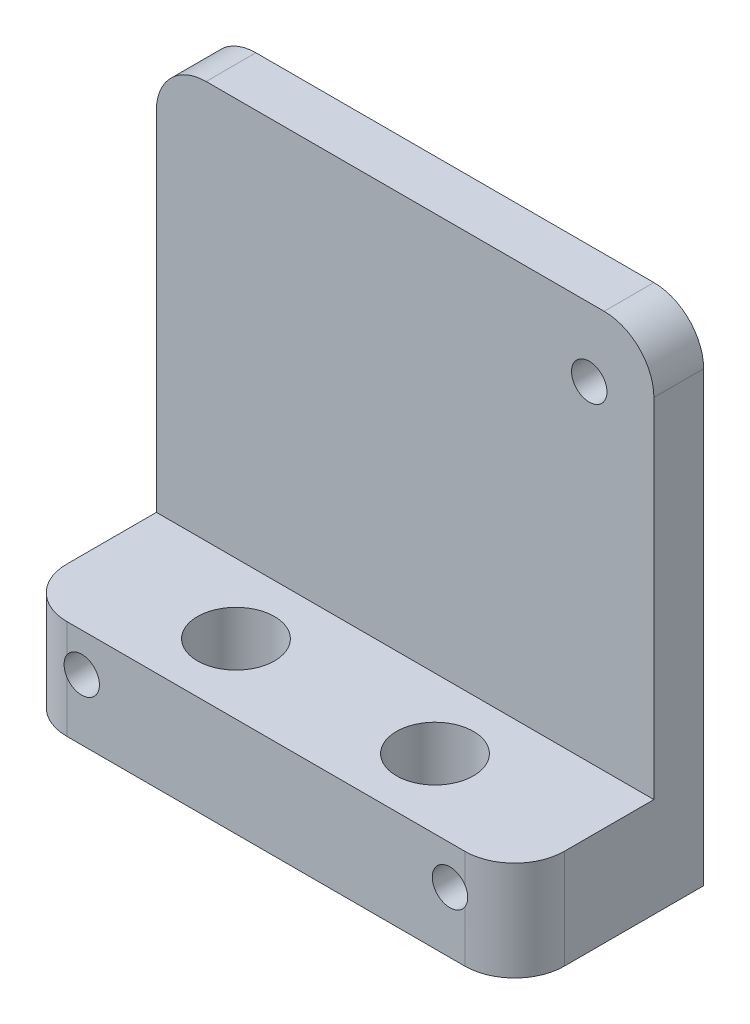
SolidWorks part; units mm, degrees
ref_plane "Front Plane" through (0, 0, 0) normal (0, 0, 1) x (1, 0, 0)
ref_plane "Top Plane" through (0, 0, 0) normal (0, 1, 0) x (1, 0, 0)
ref_plane "Right Plane" through (0, 0, 0) normal (1, 0, 0) x (0, 0, -1)
sketch "Sketch1" plane through (0, 0, 0) normal (1, 0, 0) x (0, 0, -1)
  line L0 (-12.065, 0) -> (0, 0)
  line L1 (0, 0) -> (0, 31.75)
  line L2 (0, 31.75) -> (-3.175, 31.75)
  line L3 (-3.175, 31.75) -> (-3.175, 6.35)
  line L4 (-3.175, 6.35) -> (-12.065, 6.35)
  line L5 (-12.065, 6.35) -> (-12.065, 0)
  dimension "D1" = 3.175
  dimension "D2" = 6.35
  dimension "D3" = 31.75
  dimension "D4" = 8.89
extrude "Boss-Extrude1" add sketch "Sketch1" along normal mid plane 31.75
hole_wizard "#4-40 Tapped Hole1" positions "Sketch3" profile "Sketch4" tap size "#4-40" standard "ANSI Inch"
sketch "Sketch3" plane through (0, 0, 0) normal (0, 0, -1) x (-1, 0, 0)
  circle A0 centre (-11.75, 27.385) radius 2.7 construction
  circle A1 centre (-11.75, 3.885) radius 2.7 construction
  circle A2 centre (11.75, 3.885) radius 2.7 construction
  point P0 (-11.75, 27.385)
  point P2 (-11.75, 3.885)
  point P4 (11.75, 3.885)
sketch "Sketch4" plane through (11.75, 27.385, 0) normal (1, 0, 0) x (0, 1, 0)
  line L0 (0, 0) -> (0, 12.065)
  line L1 (0, 12.065) -> (1.1303, 12.065)
  line L2 (1.1303, 12.065) -> (1.1303, 0)
  line L5 (1.1303, 0) -> (0, 0)
  line L11 (0, -6.35) -> (0, 107.95) construction
  dimension "Thru Tap Drill Dia." = 2.2606
  dimension "Thru Tap Drill Depth" = 12.065
hole_wizard "#10 (0.1935) Diameter Hole1" positions "Sketch5" profile "Sketch6" hole size "#10" standard "ANSI Inch"
sketch "Sketch5" plane through (0, 6.35, 0) normal (0, 1, 0) x (1, 0, 0)
  line L0 (-15.875, -7.62) -> (15.875, -7.62) construction
  line L1 (-15.875, -3.175) -> (-15.875, -12.065) construction
  line L2 (15.875, -3.175) -> (15.875, -12.065) construction
  line L3 (0, -3.175) -> (0, -7.62) construction
  line L4 (15.875, -3.175) -> (-15.875, -3.175) construction
  point P0 (-6.35, -7.62)
  point P2 (6.35, -7.62)
  dimension "D1" = 12.7
sketch "Sketch6" plane through (-6.35, 6.35, 7.62) normal (1, 0, 0) x (0, 0, 1)
  line L0 (0, 0) -> (0, 6.35)
  line L1 (0, 6.35) -> (2.4574, 6.35)
  line L2 (2.4574, 6.35) -> (2.4574, 0)
  line L5 (2.4574, 0) -> (0, 0)
  line L11 (0, -6.35) -> (0, 107.95) construction
  dimension "Thru Hole Dia." = 4.9149
  dimension "Thru Hole Depth" = 6.35
fillet "Fillet1" radius 3.175 4 edges at (-15.875, 3.175, 12.065) (15.875, 3.175, 12.065) (15.875, 31.75, 1.5875) (-15.875, 31.75, 1.5875)
